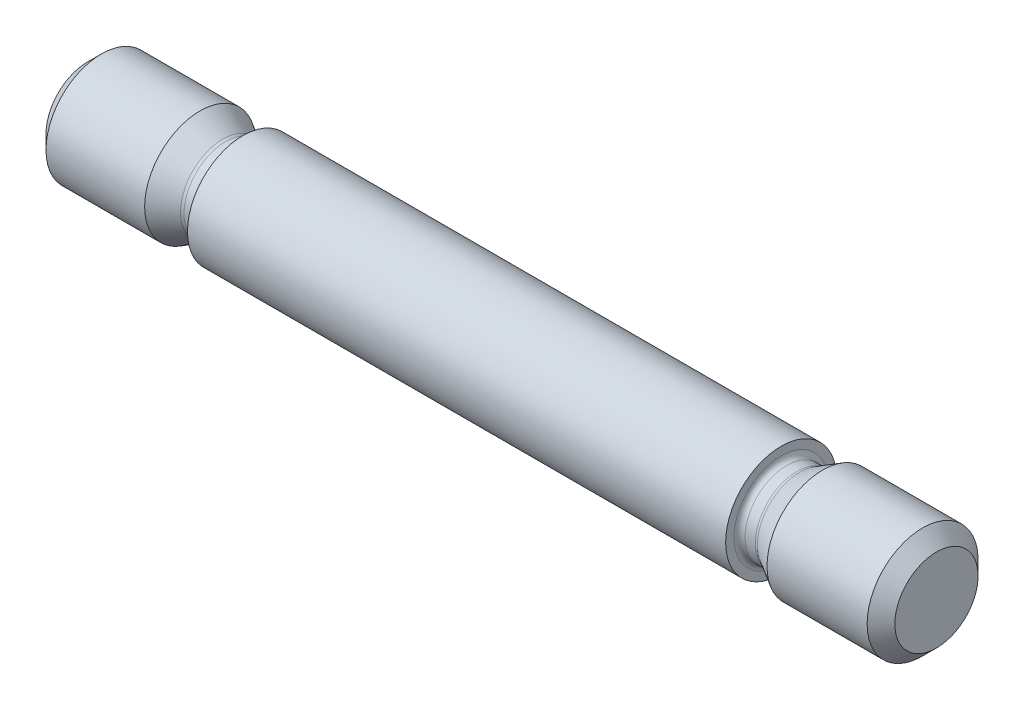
SolidWorks part; units mm, degrees
ref_plane "Plane1" through (0, 0, 0) normal (0, 0, 1) x (1, 0, 0)
ref_plane "Plane2" through (0, 0, 0) normal (0, 1, 0) x (1, 0, 0)
ref_plane "Plane3" through (0, 0, 0) normal (1, 0, 0) x (0, 0, -1)
sketch "BodySke" plane through (0, 0, 0) normal (0, 0, 1) x (1, 0, 0)
  line L0 (19.5, 6.1072) -> (16.2215, 8)
  line L1 (16.2215, 8) -> (2, 8)
  line L2 (22.4, 8) -> (22.4, 6.8)
  line L3 (21.6, 6) -> (19.9, 6)
  line L5 (2, 8) -> (0, 6)
  line L7 (100, 8) -> (100, 6.8)
  line L8 (100.8, 6) -> (102.2856, 6)
  line L9 (102.6856, 6.1072) -> (105.9641, 8)
  line L10 (105.9641, 8) -> (120.4, 8)
  line L11 (120.4, 8) -> (122.4, 6)
  line L12 (122.4, 6) -> (122.4, 0)
  line L13 (122.4, 0) -> (0, 0)
  line L14 (-3.175, 0) -> (101.6, 0) construction
  line L15 (108.7794, -6) -> (122.4, -6) construction
  line L16 (100, -6) -> (102.5, -6) construction
  line L17 (37.0699, -8) -> (100, -8) construction
  line L18 (0, 6) -> (0, 0)
  line L19 (22.4, 8) -> (100, 8)
  line L20 (104.5, 10.8514) -> (104.5, -6.5014) construction
  line L21 (100, 10.2761) -> (100, -5.5735) construction
  arc A0 (19.9, 6) -> (19.5, 6.1072) centre (19.9, 6.8) cw
  arc A1 (22.4, 6.8) -> (21.6, 6) centre (21.6, 6.8) cw
  arc A2 (102.2856, 6) -> (102.6856, 6.1072) centre (102.2856, 6.8) ccw
  arc A3 (100, 6.8) -> (100.8, 6) centre (100.8, 6.8) ccw
  point P26 (102.5, 6)
  point P29 (100, 6)
  dimension "Length" = 100
  dimension "Thread_neck_width" = 2.5
  dimension "Shoulder_neck_width" = 2.5
  dimension "Advance" = 2
  dimension "Thread_nom" = 22.4
  dimension "Thread_lim" = 17.9
  dimension "Studend_length" = 22.4
  dimension "Thread_len" = 22.4
revolve "BaseBody" add sketch "BodySke" angle 360 about L14
sketch "ThdSchSke" plane through (0, 0, 0) normal (0, 0, 1) x (1, 0, 0)
  line L0 (104.5, -6) -> (103.0996, -8)
  line L1 (104.5, -6) -> (105.9004, -8)
  line L2 (105.9004, -8) -> (105.9004, -10)
  line L3 (-3.175, 0) -> (5.1513, 0) construction
  line L5 (105.9004, -10) -> (103.0996, -10)
  line L6 (103.0996, -10) -> (103.0996, -8)
  line L7 (122.4, -6) -> (122.4, 6) construction
  dimension "Thread_minor" = 12
  dimension "Diameter" = 16
  dimension "Start" = 17.9
  dimension "SideAngle" = 55
  dimension "VeeAngle" = 70
  dimension "Overcut" = 20
revolve "ThreadSchematic" [suppressed] cut sketch "ThdSchSke" angle 360 about L3
pattern_linear "ThdSchPat" [suppressed]
sketch "ThdSchSketStud" plane through (0, 0, 0) normal (0, 0, 1) x (1, 0, 0)
  line L0 (17.9, -6) -> (16.4996, -8)
  line L1 (17.9, -6) -> (19.3004, -8)
  line L2 (19.3004, -8) -> (19.3004, -10)
  line L3 (-3.175, 0) -> (5.1513, 0) construction
  line L5 (19.3004, -10) -> (16.4996, -10)
  line L6 (16.4996, -10) -> (16.4996, -8)
  line L7 (0, 6) -> (0, -6) construction
  dimension "Thread_minor" = 12
  dimension "Diameter" = 16
  dimension "SideAngle" = 55
  dimension "VeeAngle" = 70
  dimension "Overcut" = 20
  dimension "Start_" = 17.9
revolve "ThreadSchematicStud" [suppressed] cut sketch "ThdSchSketStud" angle 360 about L3
pattern_linear "ThdSchPatStud" [suppressed]
equation "\"Thread_len@BodySke\" = \"Thread_nom@BodySke\""
equation "\"Studend_length@BodySke\" = \"Thread_len@BodySke\""
equation "\"Thread_minor@ThreadCosmetic\" = \"Minor_dia@BodySke\""
equation "\"Thrd_minor@ThreadCosmeticStud\" = \"Thread_minor@ThreadCosmetic\""
equation "\"Thread_minor@ThdSchSke\" = \"Minor_dia@BodySke\""
equation "\"Diameter@ThdSchSke\" = \"Thread_dia@BodySke\""
equation "\"Overcut@ThdSchSke\" = \"Thread_dia@BodySke\" * 1.25"
equation "\"Start@ThdSchSke\" = \"Thread_nom@BodySke\"  - \"Thread_neck_width@BodySke\" - \"Advance@BodySke\""
equation "\"Num_threads@ThdSchPat\" = int( \"Start@ThdSchSke\" / \"Advance@BodySke\" + 0.999 ) + 1"
equation "\"Advance@ThdSchPat\" = \"Start@ThdSchSke\" /  ( \"Num_threads@ThdSchPat\" - 1 ) 'relax it"
equation "'  \"Num_threads@ThdSchPat\" = \"Num_threads@ThdSchPat\" - sgn( \"Num_threads@ThdSchPat\" - 1 ) '---chamfered tips only---"
equation "\"Diameter@ThdSchSketStud\" = \"Diameter@ThdSchSke\""
equation "\"Thread_minor@ThdSchSketStud\" = \"Thread_minor@ThdSchSke\""
equation "\"Overcut@ThdSchSketStud\" = \"Overcut@ThdSchSke\""
equation "\"Start_@ThdSchSketStud\" = \"Studend_length@BodySke\" - \"Shoulder_neck_width@BodySke\" - \"Advance@BodySke\""
equation "\"Num_threads@ThdSchPatStud\" = int( \"Start_@ThdSchSketStud\"/ \"Advance@BodySke\" + 0.999 )  + 1"
equation "\"Advance@ThdSchPatStud\" = \"Start_@ThdSchSketStud\" /  ( \"Num_threads@ThdSchPatStud\" - 1 ) 'relax it"
